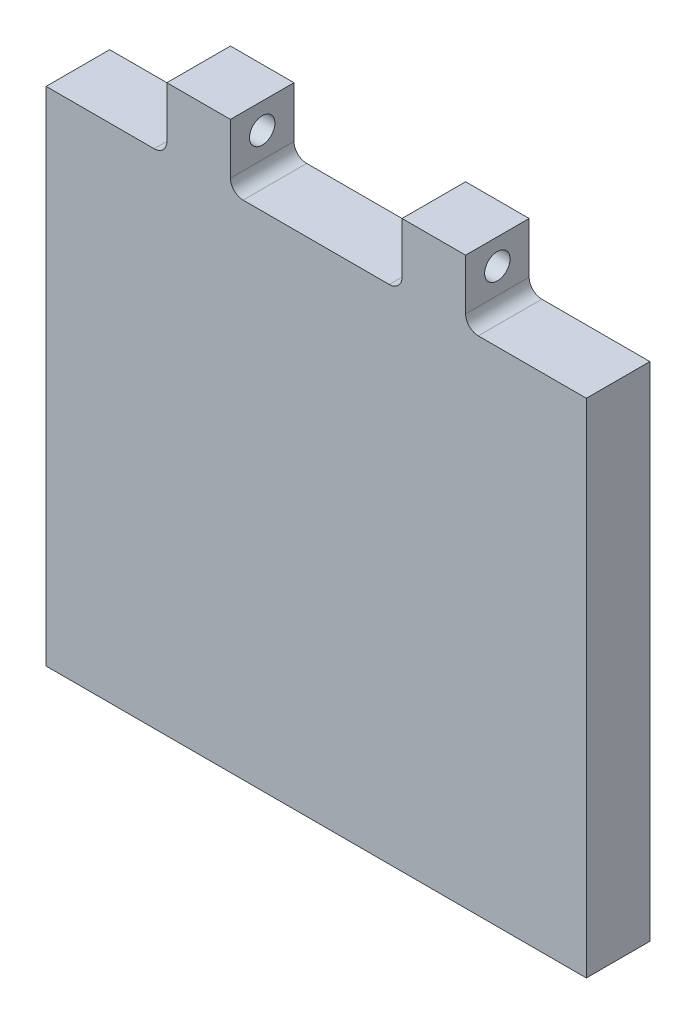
SolidWorks part; units mm, degrees
ref_plane "Plan de face" through (0, 0, 0) normal (0, 0, 1) x (1, 0, 0)
ref_plane "Plan de dessus" through (0, 0, 0) normal (0, 1, 0) x (1, 0, 0)
ref_plane "Plan de droite" through (0, 0, 0) normal (1, 0, 0) x (0, 0, -1)
sketch "Esquisse1" plane through (0, 0, 0) normal (0, 0, 1) x (1, 0, 0)
  line L0 (0, 104.6385) -> (0, -46.0033) construction
  line L1 (42.5, 0) -> (-42.5, 0)
  line L2 (-42.5, 0) -> (-42.5, 79)
  line L3 (-42.5, 79) -> (-25.5, 79)
  line L4 (-23.5, 81) -> (-23.5, 89)
  line L5 (-23.5, 89) -> (-13.5, 89)
  line L6 (-13.5, 89) -> (-13.5, 81)
  line L7 (-11.5, 79) -> (11.5, 79)
  line L8 (13.5, 89) -> (13.5, 81)
  line L9 (23.5, 89) -> (13.5, 89)
  line L10 (23.5, 81) -> (23.5, 89)
  line L11 (42.5, 79) -> (25.5, 79)
  line L12 (42.5, 0) -> (42.5, 79)
  arc A0 (-23.5, 81) -> (-25.5, 79) centre (-25.5, 81) cw
  arc A1 (-11.5, 79) -> (-13.5, 81) centre (-11.5, 81) cw
  arc A2 (11.5, 79) -> (13.5, 81) centre (11.5, 81) ccw
  arc A3 (23.5, 81) -> (25.5, 79) centre (25.5, 81) ccw
  point P21 (0, 79)
  point P25 (0, 0)
  dimension "D5" = 2
  dimension "D1" = 42.5
  dimension "D2" = 79
  dimension "D3" = 19
  dimension "D4" = 10
  dimension "D6" = 89
extrude "Extrusion1" add sketch "Esquisse1" against normal blind 10
sketch "Esquisse2" plane through (-23.5, 0, 0) normal (-1, 0, 0) x (0, 0, 1)
  line L0 (-10, 89) -> (-10, 81) construction
  line L1 (-10, 89) -> (0, 89) construction
  circle A0 centre (-5, 85) radius 2
  dimension "D3" = 4
  dimension "D1" = 5
  dimension "D2" = 4
extrude "Enlèv. mat.-Extru.1" cut sketch "Esquisse2" against normal through all
